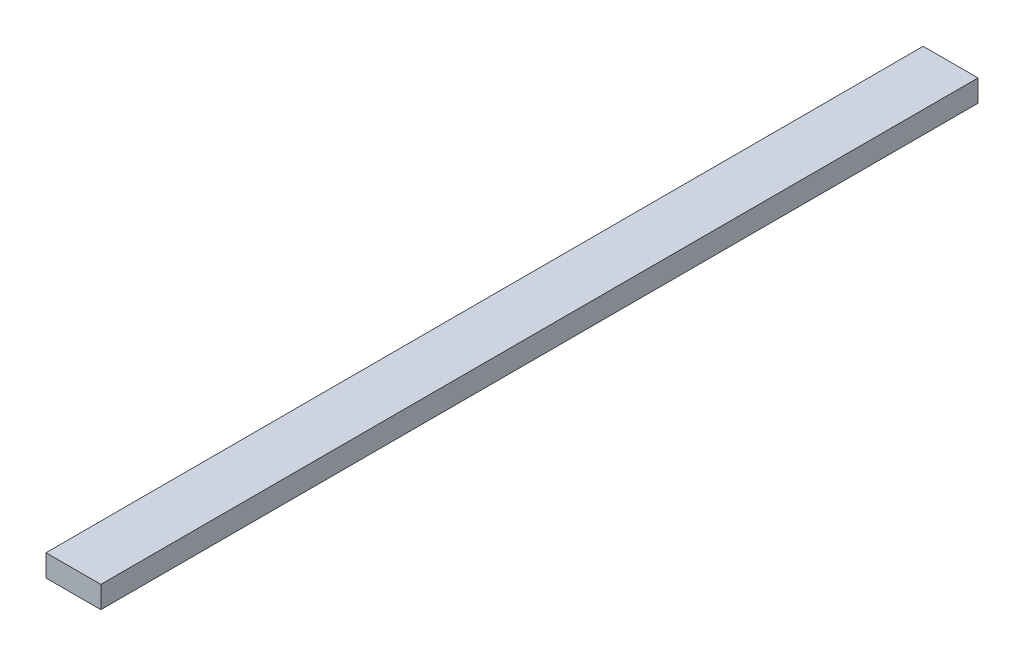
SolidWorks part; units mm, degrees
ref_plane "Plan de face" through (0, 0, 0) normal (0, 0, 1) x (1, 0, 0)
ref_plane "Plan de dessus" through (0, 0, 0) normal (0, 1, 0) x (1, 0, 0)
ref_plane "Plan de droite" through (0, 0, 0) normal (1, 0, 0) x (0, 0, -1)
sketch "Esquisse1" plane through (0, 0, 0) normal (0, 0, 1) x (1, 0, 0)
  line L1 (0, 0) -> (5, 0)
  line L2 (0, 0) -> (0, 2)
  line L3 (0, 2) -> (5, 2)
  line L4 (5, 0) -> (5, 2)
  dimension "D1" = 5
  dimension "D2" = 2
extrude "Extrusion1" add sketch "Esquisse1" along normal blind 80
